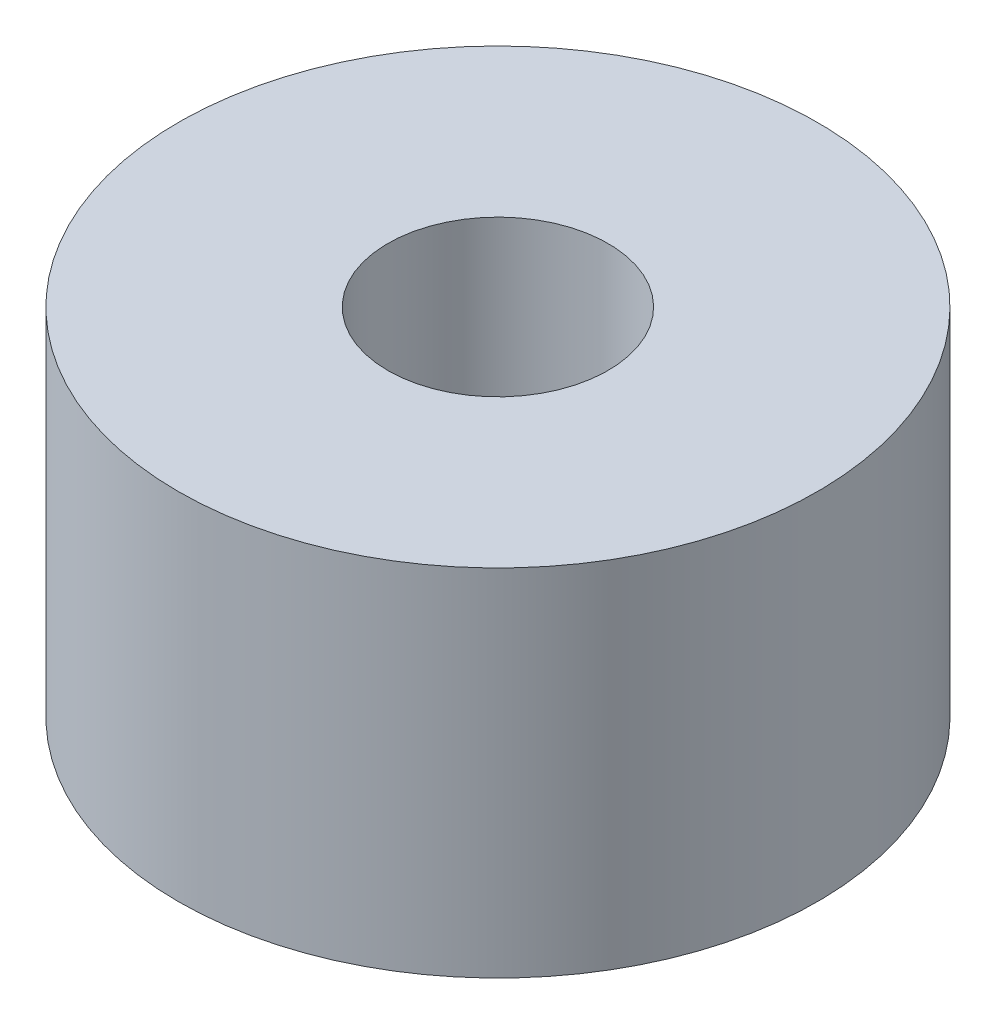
SolidWorks part; units mm, degrees
ref_plane "Front Plane" through (0, 0, 0) normal (0, 0, 1) x (1, 0, 0)
ref_plane "Top Plane" through (0, 0, 0) normal (0, 1, 0) x (1, 0, 0)
ref_plane "Right Plane" through (0, 0, 0) normal (1, 0, 0) x (0, 0, -1)
sketch "Sketch1" plane through (0, 0, 0) normal (0, 1, 0) x (1, 0, 0)
  circle A0 centre (0, 0) radius 4.5
  circle A1 centre (0, 0) radius 1.55
  dimension "D1" = 9
  dimension "D2" = 3.1
extrude "Boss-Extrude1" add sketch "Sketch1" along normal blind 5
